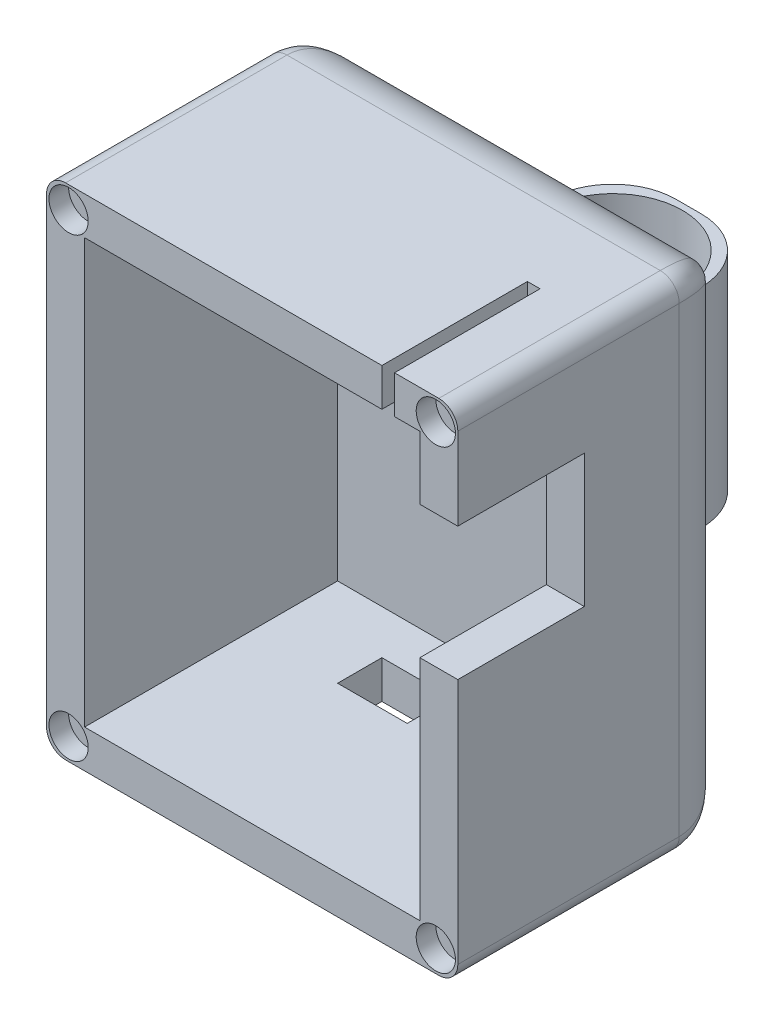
SolidWorks part; units mm, degrees
ref_plane "정면" through (0, 0, 0) normal (0, 0, 1) x (1, 0, 0)
ref_plane "윗면" through (0, 0, 0) normal (0, 1, 0) x (1, 0, 0)
ref_plane "우측면" through (0, 0, 0) normal (1, 0, 0) x (0, 0, -1)
sketch "스케치1" plane through (0, 0, 0) normal (0, 0, 1) x (1, 0, 0)
  line L1 (0, 0) -> (65, 0)
  line L2 (0, 0) -> (0, 79)
  line L3 (0, 79) -> (65, 79)
  line L4 (65, 0) -> (65, 79)
  dimension "D1" = 79
  dimension "D2" = 65
extrude "보스-돌출1" add sketch "스케치1" along normal blind 45
sketch "스케치3" plane through (0, 0, 45) normal (0, 0, 1) x (1, 0, 0)
  line L0 (32.5, 79) -> (32.5, 0) construction
  line L1 (65, 79) -> (0, 79) construction
  line L2 (0, 0) -> (65, 0) construction
  line L3 (0, 39.5) -> (65, 39.5) construction
  line L4 (0, 79) -> (0, 0) construction
  line L5 (65, 0) -> (65, 79) construction
  line L7 (6, 6) -> (59, 6)
  line L8 (6, 6) -> (6, 73)
  line L9 (6, 73) -> (59, 73)
  line L10 (59, 6) -> (59, 73)
  line L11 (32.5, 73) -> (32.5, 6) construction
  line L12 (6, 39.5) -> (59, 39.5) construction
  point P12 (32.5, 39.5)
  dimension "D1" = 53
  dimension "D2" = 67
extrude "컷-돌출1" cut sketch "스케치3" against normal blind 40
sketch "스케치4" plane through (0, 0, 45) normal (0, 0, 1) x (1, 0, 0)
  line L0 (0, 79) -> (6, 73) construction
  line L1 (32.5, 79) -> (32.5, 0) construction
  line L2 (65, 79) -> (0, 79) construction
  line L3 (0, 0) -> (65, 0) construction
  line L4 (0, 39.5) -> (65, 39.5) construction
  line L5 (0, 79) -> (0, 0) construction
  line L6 (65, 0) -> (65, 79) construction
  circle A0 centre (3.4747, 75.5253) radius 3.1
  circle A1 centre (61.5253, 75.5253) radius 3.1
  circle A2 centre (61.5253, 3.4747) radius 3.1
  circle A3 centre (3.4747, 3.4747) radius 3.1
  dimension "D1" = 6.2
extrude "컷-돌출2" cut sketch "스케치4" against normal blind 3.1 contours A3 | A2 | A1 | A0
sketch "스케치5" plane through (65, 0, 0) normal (1, 0, 0) x (0, 0, -1)
  line L0 (0, 79) -> (-25, 79) construction
  line L1 (-45, 79) -> (0, 79) construction
  line L2 (-25, 79) -> (-25, 63) construction
  line L3 (-45, 0) -> (-45, 79) construction
  line L4 (-25, 63) -> (-45, 63)
  line L5 (-25, 63) -> (-25, 42)
  line L6 (-25, 42) -> (-45, 42)
  line L7 (-45, 63) -> (-45, 42)
  dimension "D1" = 25
  dimension "D2" = 16
  dimension "D3" = 21
extrude "컷-돌출3" cut sketch "스케치5" against normal blind 8
sketch "스케치6" plane through (0, 79, 0) normal (0, 1, 0) x (1, 0, 0)
  line L0 (65, -34.0594) -> (55, -34.0594) construction
  line L1 (65, -45) -> (65, 0) construction
  line L2 (55, -45) -> (55, -22) construction
  line L3 (65, -45) -> (0, -45) construction
  line L4 (55, -45) -> (53.0018, -45) construction
  line L5 (55, -45) -> (53.0018, -45)
  line L6 (53.0018, -45) -> (53.0018, -22)
  line L7 (53.0018, -22) -> (55, -22)
  line L8 (55, -22) -> (55, -45)
  dimension "D1" = 10
  dimension "D2" = 23
extrude "컷-돌출4" cut sketch "스케치6" against normal blind 8 contours L6 L7 L8 L5
sketch "스케치7" plane through (0, 0, 0) normal (0, -1, 0) x (1, 0, 0)
  line L0 (0, 0) -> (20, 0) construction
  line L1 (0, 0) -> (65, 0) construction
  line L2 (20, 0) -> (20, 12) construction
  line L4 (20, 12) -> (31, 12)
  line L5 (20, 12) -> (20, 19)
  line L6 (20, 19) -> (31, 19)
  line L7 (31, 12) -> (31, 19)
  dimension "D1" = 20
  dimension "D2" = 12
  dimension "D3" = 11
  dimension "D4" = 7
extrude "컷-돌출5" cut sketch "스케치7" against normal blind 8
sketch "스케치8" plane through (0, 0, 0) normal (0, 0, -1) x (-1, 0, 0)
  line L0 (-32.5, 79) -> (-32.5, 0) construction
  line L1 (-65, 79) -> (0, 79) construction
  line L2 (0, 0) -> (-65, 0) construction
  line L3 (-65, 39.5) -> (0, 39.5) construction
  line L4 (-65, 0) -> (-65, 79) construction
  line L5 (0, 79) -> (0, 0) construction
  line L7 (-44.5, 23) -> (-20.5, 23)
  line L8 (-44.5, 23) -> (-44.5, 56)
  line L9 (-44.5, 56) -> (-20.5, 56)
  line L10 (-20.5, 23) -> (-20.5, 56)
  line L11 (-32.5, 56) -> (-32.5, 23) construction
  line L12 (-44.5, 39.5) -> (-20.5, 39.5) construction
  point P12 (-32.5, 39.5)
  dimension "D1" = 24
  dimension "D2" = 33
extrude "보스-돌출2" add sketch "스케치8" along normal blind 24
sketch "스케치10" plane through (0, 56, 0) normal (0, 1, 0) x (1, 0, 0)
  line L0 (32.5, 24) -> (32.5, 0) construction
  line L1 (20.5, 24) -> (44.5, 24) construction
  line L2 (20.5, 0) -> (44.5, 0) construction
  line L3 (20.5, 12) -> (44.5, 12) construction
  line L4 (20.5, 24) -> (20.5, 0) construction
  line L5 (44.5, 24) -> (44.5, 0) construction
  circle A0 centre (32.5, 12) radius 11.0011
extrude "컷-돌출6" cut sketch "스케치10" against normal blind 35
fillet "필렛1" radius 3 4 edges at (0, 79, 22.5) (65, 79, 22.5) (65, 0, 22.5) (0, 0, 22.5)
fillet "필렛2" radius 10 8 edges at (64.1213, 78.1213, 0) (65, 39.5, 0) (64.1213, 0.8787, 0) (32.5, 0, 0) (0.8787, 0.8787, 0) (0, 39.5, 0) (0.8787, 78.1213, 0) (32.5, 79, 0)
fillet "필렛3" radius 10 2 edges at (44.5, 39.5, -24) (20.5, 39.5, -24)
